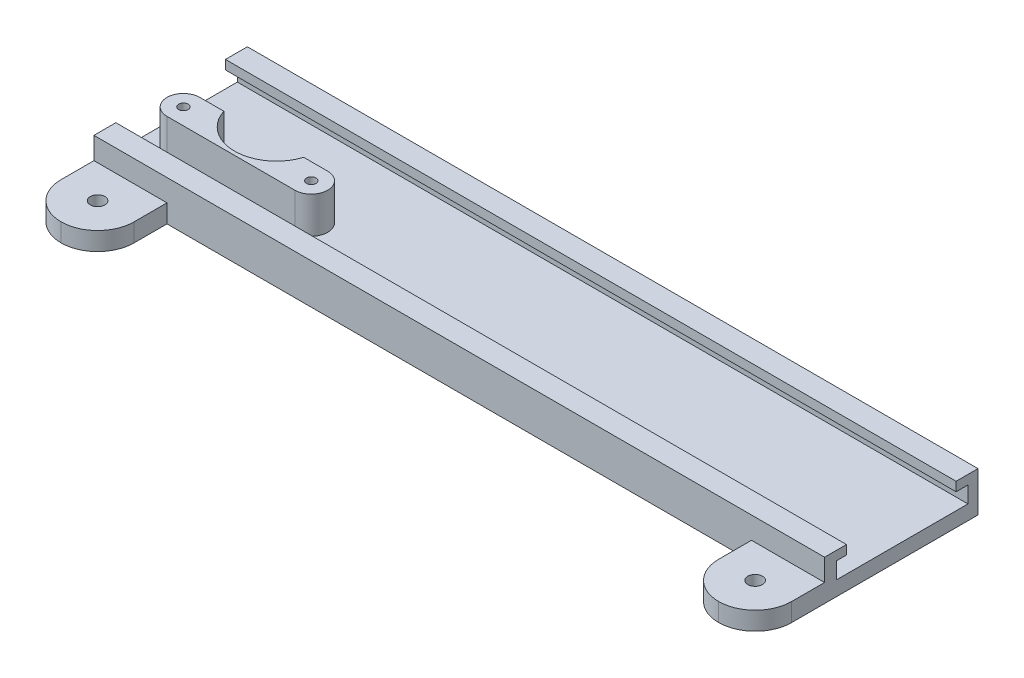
SolidWorks part; units mm, degrees
ref_plane "Front Plane" through (0, 0, 0) normal (0, 0, 1) x (1, 0, 0)
ref_plane "Top Plane" through (0, 0, 0) normal (0, 1, 0) x (1, 0, 0)
ref_plane "Right Plane" through (0, 0, 0) normal (1, 0, 0) x (0, 0, -1)
sketch "Sketch1" plane through (0, 0, 0) normal (0, 1, 0) x (1, 0, 0)
  line L1 (-100, -21) -> (100, -21)
  line L2 (-100, -21) -> (-100, 21)
  line L3 (-100, 21) -> (100, 21)
  line L4 (100, -21) -> (100, 21)
  line L5 (-100, -21) -> (100, 21) construction
  line L6 (-100, 21) -> (100, -21) construction
  point P0 (0, 0)
  dimension "D1" = 200
  dimension "D2" = 42
extrude "Boss-Extrude1" add sketch "Sketch1" along normal blind 4
sketch "Sketch2" plane through (100, 0, 0) normal (1, 0, 0) x (0, 0, -1)
  line L0 (21, 4) -> (21, 11)
  line L1 (21, 11) -> (15, 11)
  line L2 (15, 11) -> (15, 8.5)
  line L3 (15, 8.5) -> (18.25, 8.5)
  line L4 (18.25, 8.5) -> (18.25, 4)
  line L5 (-21, 4) -> (21, 4) construction
  line L6 (18.25, 4) -> (21, 4)
  line L7 (-21, 0) -> (21, 0) construction
  line L8 (-21, 4) -> (-21, 11)
  line L9 (-21, 11) -> (-15, 11)
  line L10 (-15, 11) -> (-15, 8.5)
  line L11 (-15, 8.5) -> (-17.75, 8.5)
  line L12 (-17.75, 8.5) -> (-17.75, 4)
  line L13 (-17.75, 4) -> (-21, 4)
  dimension "D1" = 6
  dimension "D2" = 3.25
  dimension "D3" = 11
  dimension "D4" = 4.5
  dimension "D5" = 11
  dimension "D6" = 6
  dimension "D7" = 2.75
  dimension "D8" = 4.5
extrude "Boss-Extrude2" add sketch "Sketch2" against normal up to vertex
sketch "Sketch3" plane through (0, 0, 0) normal (0, -1, 0) x (1, 0, 0)
  line L1 (100, 21) -> (80, 21)
  line L2 (100, 21) -> (100, 40)
  line L3 (100, 40) -> (80, 40)
  line L4 (80, 21) -> (80, 40)
  dimension "D1" = 20
  dimension "D2" = 19
extrude "Boss-Extrude3" add sketch "Sketch3" against normal blind 5
fillet "Fillet1" radius 10 1 edges at (100, 2.5, 40)
fillet "Fillet2" radius 10 1 edges at (80, 2.5, 40)
sketch "Sketch4" plane through (0, 5, 0) normal (0, 1, 0) x (1, 0, 0)
  circle A0 centre (90, -30) radius 2
  dimension "D1" = 4
extrude "Cut-Extrude1" cut sketch "Sketch4" against normal through all
mirror "Mirror1" about plane through (0, 0, 0) normal (1, 0, 0) of "Cut-Extrude1", "Fillet2", "Fillet1", "Boss-Extrude3"
sketch "Sketch5" plane through (0, 4, 0) normal (0, 1, 0) x (1, 0, 0)
  line L0 (-91.5, -5) -> (-56.5, -5) construction
  line L1 (-91.5, -0.5) -> (-56.5, -0.5)
  line L2 (-91.5, -9.5) -> (-56.5, -9.5)
  line L3 (-100, -17.75) -> (100, -17.75) construction
  line L4 (-100, 18.25) -> (-100, -17.75) construction
  arc A0 (-91.5, -0.5) -> (-91.5, -9.5) centre (-91.5, -5) ccw
  arc A1 (-56.5, -9.5) -> (-56.5, -0.5) centre (-56.5, -5) ccw
  point P2 (-74, -5)
  dimension "D4" = 4
  dimension "D1" = 9
  dimension "D2" = 35
  dimension "D3" = 12.75
extrude "Boss-Extrude4" add sketch "Sketch5" along normal blind 10
sketch "Sketch6" plane through (0, 14, 0) normal (0, 1, 0) x (1, 0, 0)
  circle A0 centre (-91.5, -5) radius 1.3
  circle A1 centre (-56.5, -5) radius 1.3
  dimension "D1" = 2.6
  dimension "D2" = 2.6
extrude "Cut-Extrude2" cut sketch "Sketch6" against normal up to surface (10 mm away)
sketch "Sketch7" plane through (0, 14, 0) normal (0, 1, 0) x (1, 0, 0)
  line L0 (-56.5, -0.5) -> (-91.5, -0.5) construction
  line L1 (-91.5, -9.5) -> (-56.5, -9.5) construction
  circle A0 centre (-56.5, -5) radius 1.3 construction
  circle A1 centre (-91.5, -5) radius 1.3 construction
  circle A2 centre (-74.005, 2.9734) radius 11.4734
  point P0 (-63.07, -0.5)
  point P1 (-84.94, -0.5)
  point P4 (-74, -8.5)
  dimension "D1" = 1
  dimension "D2" = 6.57
  dimension "D3" = 6.56
extrude "Cut-Extrude3" cut sketch "Sketch7" against normal up to surface (10 mm away)
